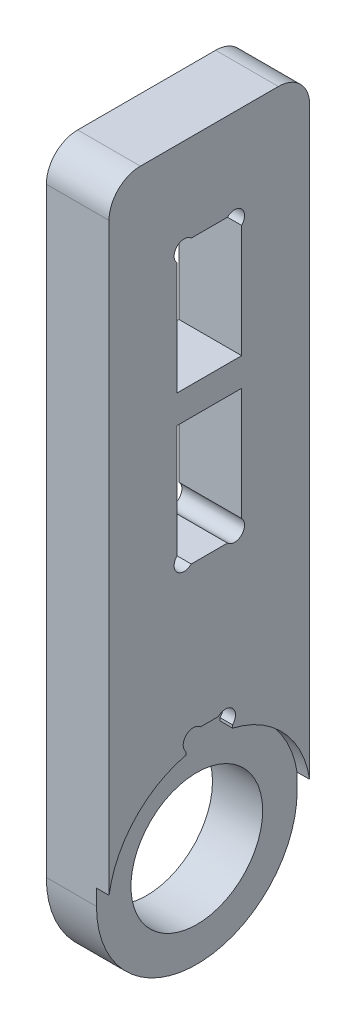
SolidWorks part; units mm, degrees
ref_plane "Plan de face" through (0, 0, 0) normal (0, 0, 1) x (1, 0, 0)
ref_plane "Plan de dessus" through (0, 0, 0) normal (0, 1, 0) x (1, 0, 0)
ref_plane "Plan de droite" through (0, 0, 0) normal (1, 0, 0) x (0, 0, -1)
sketch "Esquisse1" plane through (0, 0, 0) normal (1, 0, 0) x (0, 0, -1)
  line L0 (0, -30.1976) -> (0, 109.7201) construction
  line L1 (40.0105, 0) -> (-23.4568, 0) construction
  line L2 (40.0105, 100.735) -> (-23.4568, 100.735) construction
  line L3 (16, -30.1976) -> (16, 91.617) construction
  line L4 (16, 0) -> (16, 100.735)
  line L5 (16, 100.735) -> (-16, 100.735)
  line L6 (-16, 100.735) -> (-16, 0)
  line L7 (5.15, 43.9977) -> (5.15, 61.985)
  line L8 (40.0105, 86.735) -> (-23.4568, 86.735) construction
  line L9 (-5.15, 118.4672) -> (-5.15, 20.3997) construction
  line L10 (8.8915, 41.735) -> (-23.4568, 41.735) construction
  line L11 (40.0105, 64.235) -> (-7.6815, 64.235) construction
  line L12 (-2.6768, 81.585) -> (27.4654, 81.585) construction
  line L13 (27.4654, 66.485) -> (-7.6815, 66.485) construction
  line L14 (-5.15, 86.735) -> (8.474, 73.111) construction
  line L15 (-2.8873, 86.735) -> (2.8873, 86.735)
  line L16 (-5.15, 84.4723) -> (-5.15, 66.485)
  line L17 (-5.15, 66.485) -> (5.15, 66.485)
  line L18 (5.15, 84.4723) -> (5.15, 66.485)
  line L19 (-5.15, 61.985) -> (5.15, 61.985)
  line L20 (-5.15, 43.9977) -> (-5.15, 61.985)
  line L21 (-2.8873, 41.735) -> (2.8873, 41.735)
  circle A0 centre (0, 0) radius 10.5
  arc A1 (-16, 0) -> (16, 0) centre (0, 0) ccw
  arc A2 (-2.8873, 86.735) -> (-5.15, 84.4723) centre (-4.0186, 85.6036) ccw
  arc A3 (2.8873, 86.735) -> (5.15, 84.4723) centre (4.0186, 85.6036) cw
  arc A4 (2.8873, 41.735) -> (5.15, 43.9977) centre (4.0186, 42.8664) ccw
  arc A5 (-2.8873, 41.735) -> (-5.15, 43.9977) centre (-4.0186, 42.8664) cw
  dimension "D2" = 16
  dimension "D1" = 14
  dimension "D3" = 5.15
  dimension "D5" = 45
  dimension "D6" = 22.5
  dimension "D7" = 64.235
  dimension "D8" = 5.15
  dimension "D9" = 2.25
  dimension "D10" = 45
extrude "Boss.-Extru.1" add sketch "Esquisse1" along normal blind 10
sketch "Esquisse2" plane through (10, 0, 0) normal (1, 0, 0) x (0, 0, -1)
  line L0 (0, -21.5266) -> (0, 26.6643) construction
  line L1 (33.0514, 18.5) -> (-10.6162, 18.5) construction
  line L2 (33.0514, 0) -> (-4.4401, 0) construction
  line L3 (3.7, 24.0327) -> (3.7, 15.0203) construction
  line L4 (3.7, 18.5) -> (-2.1514, 12.6486) construction
  line L5 (3.7, 16.2373) -> (3.7, 15.7718)
  line L6 (-3.7, 16.2373) -> (-3.7, 15.7718)
  line L7 (-1.4373, 18.5) -> (1.4373, 18.5)
  arc A1 (3.7, 16.2373) -> (1.4373, 18.5) centre (2.5686, 17.3686) ccw
  arc A2 (-3.7, 16.2373) -> (-1.4373, 18.5) centre (-2.5686, 17.3686) cw
  arc A3 (-3.7, 15.7718) -> (3.7, 15.7718) centre (0, 0) ccw
  dimension "D1" = 18.5
  dimension "D2" = 3.7
  dimension "D3" = 45
extrude "Enlèv. mat.-Extru.1" cut sketch "Esquisse2" against normal blind 2
fillet "Congé1" radius 5 2 edges at (5, 100.735, -16) (5, 100.735, 16)
